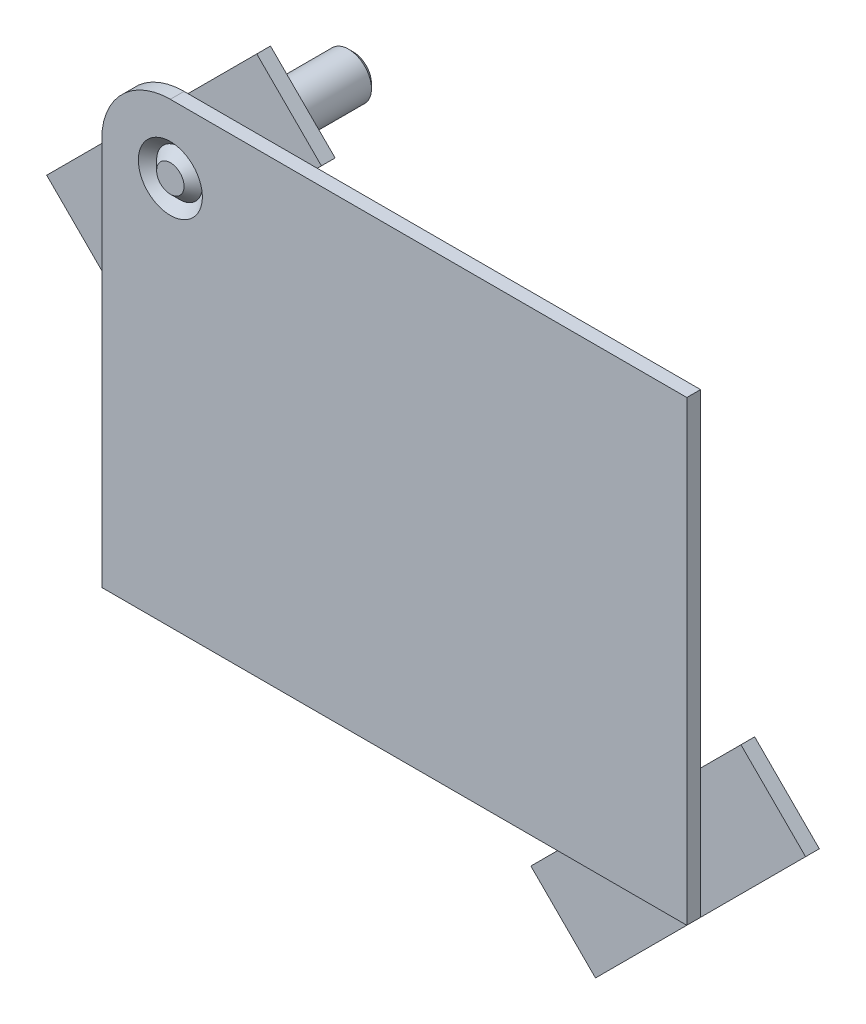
SolidWorks part; units mm, degrees
ref_plane "Face" through (0, 0, 0) normal (0, 0, 1) x (1, 0, 0)
ref_plane "Dessus" through (0, 0, 0) normal (0, 1, 0) x (1, 0, 0)
ref_plane "Droite" through (0, 0, 0) normal (1, 0, 0) x (0, 0, -1)
sketch "Esquisse1" plane through (0, 0, 0) normal (0, 0, 1) x (1, 0, 0)
  line L1 (-22.7615, 36.325) -> (90.2385, 36.325)
  line L2 (-37.7615, 21.325) -> (-37.7615, -63.675)
  line L3 (-37.7615, -63.675) -> (90.2385, -63.675)
  line L4 (90.2385, 36.325) -> (90.2385, -63.675)
  arc A0 (-37.7615, 21.325) -> (-22.7615, 36.325) centre (-22.7615, 21.325) cw
  point P6 (-37.7615, 36.325)
  dimension "D3" = 15
  dimension "D1" = 128
  dimension "D2" = 100
extrude "Extrusion1" add sketch "Esquisse1" along normal blind 3
sketch "Esquisse2" plane through (0, 0, 0) normal (0, 0, -1) x (-1, 0, 0)
  line L0 (-67.2575, -86.656) -> (-113.2194, -40.6941)
  line L1 (37.7615, -63.675) -> (-90.2385, -63.675) construction
  line L2 (-113.2194, -40.6941) -> (-99.0773, -26.5519)
  line L3 (-99.0773, -26.5519) -> (-53.1154, -72.5139)
  line L4 (-53.1154, -72.5139) -> (-67.2575, -86.656)
  line L5 (-7.2905, 37.2349) -> (38.6714, -8.7271)
  line L6 (-90.2385, 36.325) -> (22.7615, 36.325) construction
  line L7 (-7.2905, 37.2349) -> (6.8516, 51.377)
  line L8 (6.8516, 51.377) -> (52.8136, 5.4151)
  line L9 (52.8136, 5.4151) -> (38.6714, -8.7271)
  line L10 (6.8516, 51.377) -> (38.6714, -8.7271) construction
  line L11 (38.6714, -8.7271) -> (52.8136, 5.4151) construction
  line L12 (52.8136, 5.4151) -> (53.1853, 5.3902) construction
  line L13 (52.8136, 5.4151) -> (-7.2905, 37.2349) construction
  point P11 (22.7615, 21.325)
  point P16 (22.7615, 21.325)
  dimension "D1" = 65
  dimension "D2" = 45
  dimension "D3" = 20
  dimension "D4" = 45
  dimension "D5" = 65
  dimension "D6" = 20
extrude "Extrusion2" add sketch "Esquisse2" along normal blind 3 separate body
sketch "Esquisse3" plane through (0, 0, 3) normal (0, 0, 1) x (1, 0, 0)
  circle A0 centre (-22.7615, 21.325) radius 5
  dimension "D1" = 10
extrude "Enlèv. mat.-Extru.1" cut sketch "Esquisse3" against normal through all
chamfer "Chanfrein1" distance 2 angle 45 1 edges at (-17.7615, 21.325, 3)
ref_plane "Plan1" through (-22.7615, 0, 0) normal (-1, 0, 0) x (0, 0, 1)
sketch "Esquisse4" plane through (-22.7615, 0, 0) normal (-1, 0, 0) x (0, 0, 1)
  line L0 (-3, 21.325) -> (-29.208, 21.325) construction
  line L1 (-3, 26.325) -> (-3, 16.325) construction
  line L2 (-36, 26.325) -> (1, 26.325)
  line L3 (-37, 25.325) -> (-37, 21.325)
  line L4 (3, 24.325) -> (3, 21.9642)
  line L5 (3, -63.675) -> (3, 36.325) construction
  line L6 (-37, 25.325) -> (-36, 26.325)
  line L7 (1, 26.325) -> (3, 24.325)
  line L8 (-37, 21.325) -> (3, 21.325)
  line L9 (3, 21.9642) -> (3, 21.325)
  point P4 (-37, 26.325)
  point P5 (3, 26.325)
  dimension "D1" = 40
  dimension "D2" = 40
  dimension "D3" = 5
  dimension "D6" = 1
  dimension "D7" = 2
revolve "Révolution2" add sketch "Esquisse4" angle 360 about L0
sketch "Esquisse5" plane through (0, 0, -3) normal (0, 0, -1) x (-1, 0, 0)
  circle A0 centre (22.7615, 21.325) radius 6.5
extrude "Enlèv. mat.-Extru.2" cut sketch "Esquisse5" against normal blind 3
